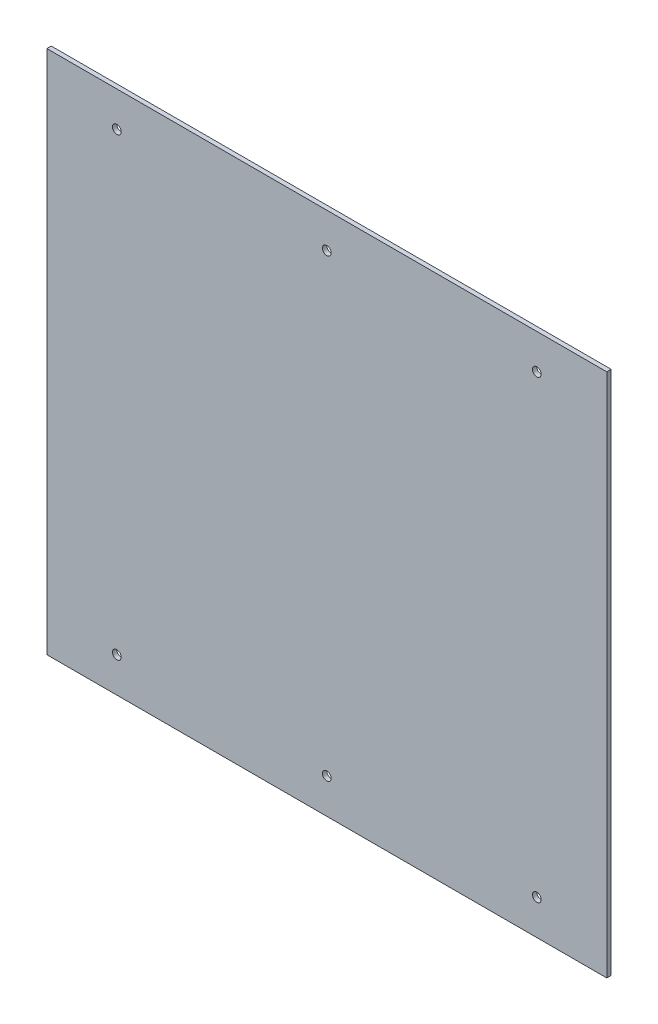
SolidWorks part; units mm, degrees
ref_plane "Front" through (0, 0, 0) normal (0, 0, 1) x (1, 0, 0)
ref_plane "Top" through (0, 0, 0) normal (0, 1, 0) x (1, 0, 0)
ref_plane "Right" through (0, 0, 0) normal (1, 0, 0) x (0, 0, -1)
sketch "스케치1" plane through (0, 0, 0) normal (0, 0, 1) x (1, 0, 0)
  line L1 (101.6, -101.6) -> (-101.6, -101.6)
  line L2 (101.6, -101.6) -> (101.6, 88.9)
  line L3 (101.6, 88.9) -> (-101.6, 88.9)
  line L4 (-101.6, -101.6) -> (-101.6, 88.9)
  line L5 (0, 88.9) -> (0, -101.6) construction
  line L6 (101.6, -6.35) -> (-101.6, -6.35) construction
  line L11 (-101.6, -12.7) -> (-101.6, 12.7) construction
  circle A0 centre (76.2, -88.9) radius 1.5875
  circle A1 centre (0, -88.9) radius 1.5875
  circle A2 centre (-76.2, -88.9) radius 1.5875
  circle A3 centre (-76.2, 76.2) radius 1.5875
  circle A4 centre (0, 76.2) radius 1.5875
  circle A5 centre (76.2, 76.2) radius 1.5875
  point P0 (0, -6.35)
  dimension "D3" = 25.4
  dimension "D12" = 3.175
  dimension "D13" = 3.175
  dimension "D14" = 3.175
  dimension "D15" = 3.175
  dimension "D16" = 3.175
  dimension "D17" = 3.175
  dimension "D18" = 12.7
  dimension "D1" = 190.5
  dimension "D2" = 203.2
  dimension "D4" = 12.7
  dimension "D5" = 12.7
  dimension "D6" = 25.4
  dimension "D7" = 25.4
  dimension "D8" = 25.4
  dimension "D9" = 12.7
  dimension "D10" = 12.7
  dimension "D11" = 12.7
extrude "보스-돌출2" add sketch "스케치1" along normal blind 1.5875
